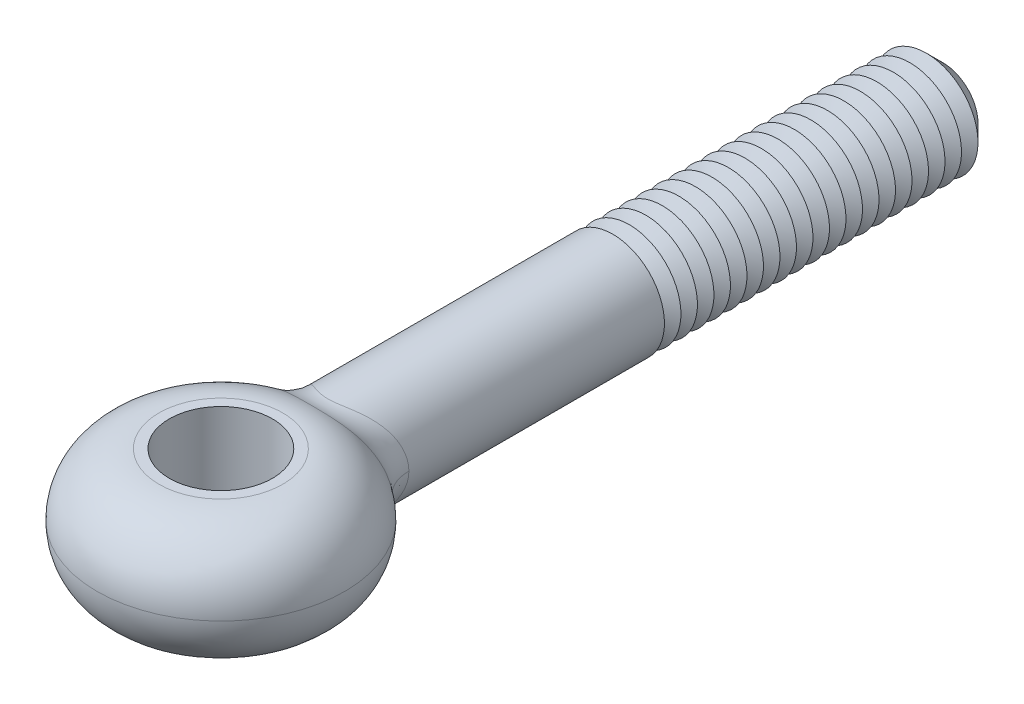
SolidWorks part; units mm, degrees
ref_plane "Front Plane" through (0, 0, 0) normal (0, 0, 1) x (1, 0, 0)
ref_plane "Top Plane" through (0, 0, 0) normal (0, 1, 0) x (1, 0, 0)
ref_plane "Right Plane" through (0, 0, 0) normal (1, 0, 0) x (0, 0, -1)
sketch "Sketch7" plane through (0, 0, 0) normal (0, 1, 0) x (1, 0, 0)
  circle A0 centre (0, 0) radius 6
  dimension "D1" = 12
extrude "Boss-Extrude3" add sketch "Sketch7" along normal mid plane 6
sketch "Sketch8" plane through (0, 0, 0) normal (0, 0, 1) x (1, 0, 0)
  circle A0 centre (0, 0) radius 2.5
  dimension "D1" = 5
extrude "Boss-Extrude4" add sketch "Sketch8" against normal blind 35
fillet "Fillet5" radius 3 2 edges at (0, -3, 6) (0, 3, 6)
fillet "Fillet6" radius 2 2 edges at (0.0752, -2.4989, -4.6594) (-0.0752, 2.4989, -4.6594)
chamfer "Chamfer1" distance 0.8 angle 45 1 edges at (2.5, 0, -35)
sketch "Sketch10" plane through (0, 0, 0) normal (0, 1, 0) x (1, 0, 0)
  line L0 (0, 28.1405) -> (0, -7.9233) construction
sketch "Sketch11" plane through (0, 0, 0) normal (0, 1, 0) x (1, 0, 0)
  line L0 (-2.5, 19) -> (-1.8072, 19.4)
  line L1 (-2.5, 34.2) -> (-2.5, 6.6144) construction
  line L2 (-1.8072, 19.4) -> (-2.5, 19.8)
  line L3 (-2.5, 19.8) -> (-2.5, 19)
  line L4 (1.7, 35) -> (-1.7, 35) construction
  dimension "D1" = 0.8
  dimension "D2" = 16
revolve "Cut-Revolve1" cut sketch "Sketch11" angle 360 about L0
pattern_linear "LPattern1" count 19 spacing 0.8 along (0, 0, -1) of "Cut-Revolve1"
sketch "Sketch12" plane through (0, 0, 0) normal (0, 1, 0) x (1, 0, 0)
  circle A0 centre (0, 0) radius 2.5
  dimension "D1" = 5
extrude "Cut-Extrude1" cut sketch "Sketch12" against normal mid plane 6
